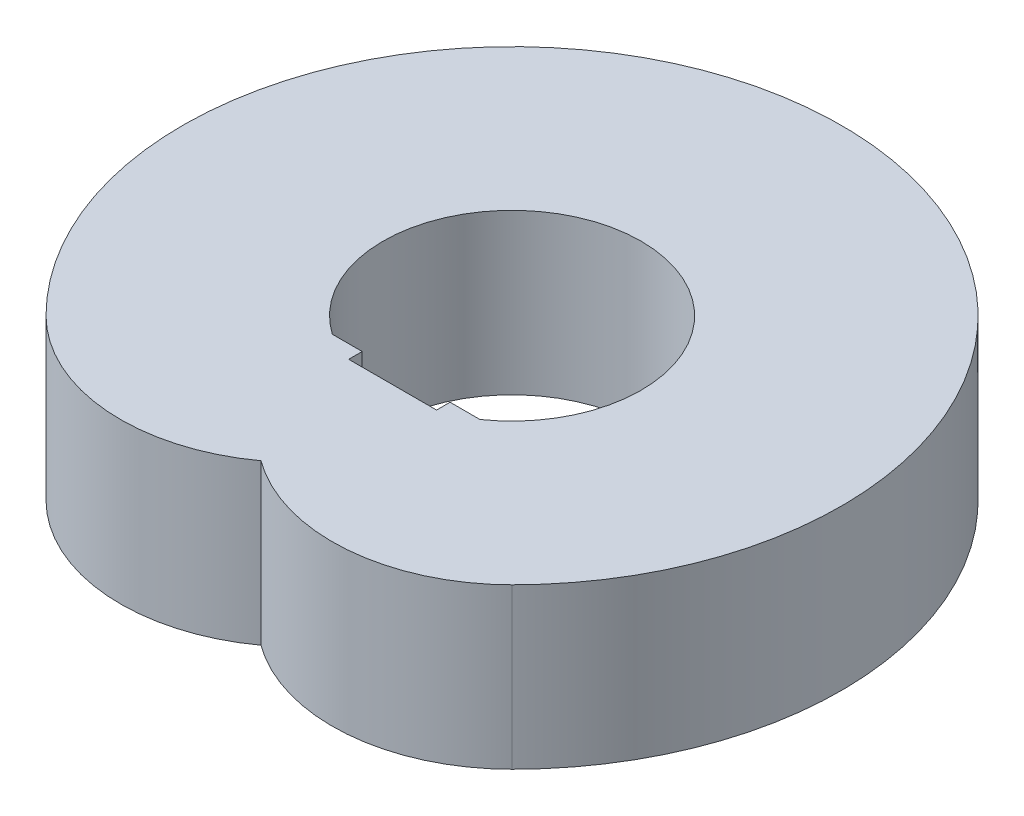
SolidWorks part; units mm, degrees
ref_plane "前视基准面" through (0, 0, 0) normal (0, 0, 1) x (1, 0, 0)
ref_plane "上视基准面" through (0, 0, 0) normal (0, 1, 0) x (1, 0, 0)
ref_plane "右视基准面" through (0, 0, 0) normal (1, 0, 0) x (0, 0, -1)
sketch "草图1" plane through (0, 0, 0) normal (0, 1, 0) x (1, 0, 0)
  line L0 (0, 0) -> (0, 825) construction
  line L1 (0, 0) -> (-583.3631, -583.3631) construction
  line L2 (0, 0) -> (583.3631, -583.3631) construction
  line L3 (0, 375) -> (318.1981, 56.8019) construction
  line L4 (0, 375) -> (-318.1981, 56.8019) construction
  line L5 (-110, -265.165) -> (-110, -299)
  line L6 (184.835, -265.165) -> (110, -265.165)
  line L7 (-110, -299) -> (110, -299)
  line L8 (110, -265.165) -> (110, -299)
  line L9 (-110, -265.165) -> (-184.835, -265.165)
  circle A0 centre (0, 0) radius 375 construction
  circle A1 centre (0, 375) radius 450 construction
  arc A2 (583.3631, -583.3631) -> (-583.3631, -583.3631) centre (0, 0) ccw
  arc A4 (-583.3631, -583.3631) -> (0, -628.741) centre (-265.165, -265.165) ccw
  arc A5 (0, -628.741) -> (583.3631, -583.3631) centre (265.165, -265.165) ccw
  arc A7 (184.835, -265.165) -> (-184.835, -265.165) centre (0, 0) ccw
  point P19 (0, -299)
  dimension "D1" = 750
  dimension "D2" = 900
  dimension "D4" = 135
  dimension "D3" = 825
  dimension "D8" = 299
  dimension "D5" = 135
  dimension "D6" = 135
  dimension "D7" = 135
  dimension "D9" = 220
extrude "凸台-拉伸1" add sketch "草图1" along normal blind 400
